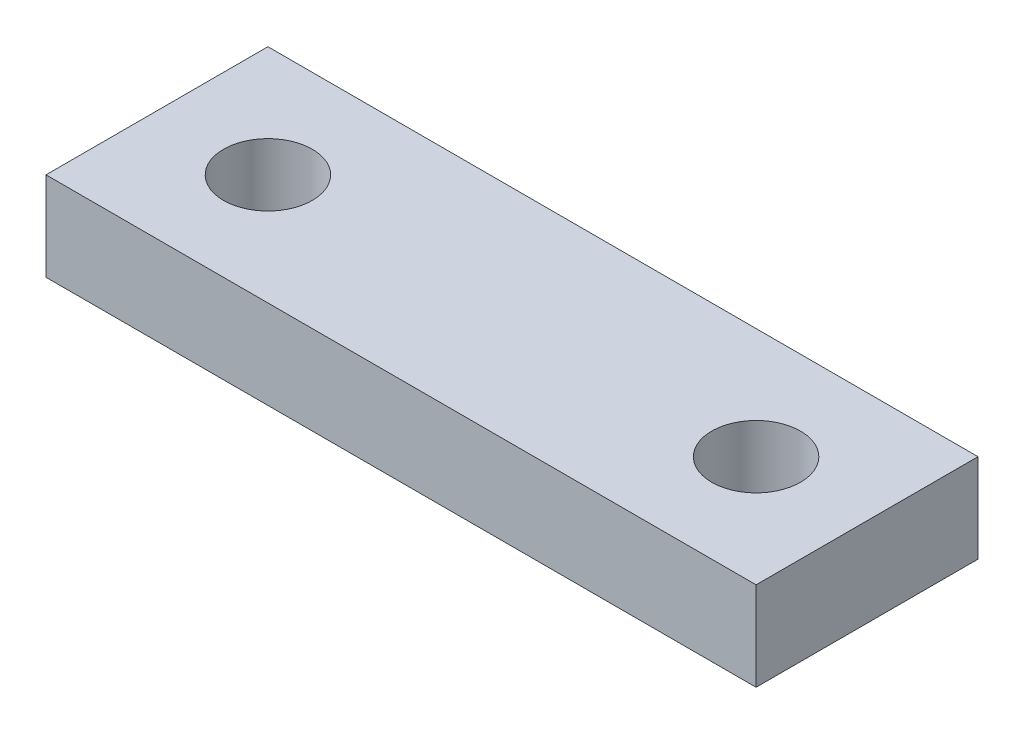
SolidWorks part; units mm, degrees
ref_plane "Front Plane" through (0, 0, 0) normal (0, 0, 1) x (1, 0, 0)
ref_plane "Top Plane" through (0, 0, 0) normal (0, 1, 0) x (1, 0, 0)
ref_plane "Right Plane" through (0, 0, 0) normal (1, 0, 0) x (0, 0, -1)
sketch "Sketch1" plane through (0, 0, 0) normal (0, 1, 0) x (1, 0, 0)
  line L1 (0, 0) -> (25.4, 0)
  line L2 (0, 0) -> (0, 7.9375)
  line L3 (0, 7.9375) -> (25.4, 7.9375)
  line L4 (25.4, 0) -> (25.4, 7.9375)
  dimension "D1" = 7.9375
  dimension "D2" = 25.4
extrude "Boss-Extrude1" add sketch "Sketch1" along normal blind 3.175
sketch "Sketch2" plane through (0, 3.175, 0) normal (0, 1, 0) x (1, 0, 0)
  circle A0 centre (21.4312, 3.9688) radius 1.5875 construction
  circle A1 centre (3.9688, 3.9688) radius 1.5875 construction
  circle A2 centre (21.4312, 3.9688) radius 1.5875
  circle A3 centre (3.9688, 3.9688) radius 1.5875
extrude "Cut-Extrude1" cut sketch "Sketch2" against normal blind 3.175 contours A2 | A3
